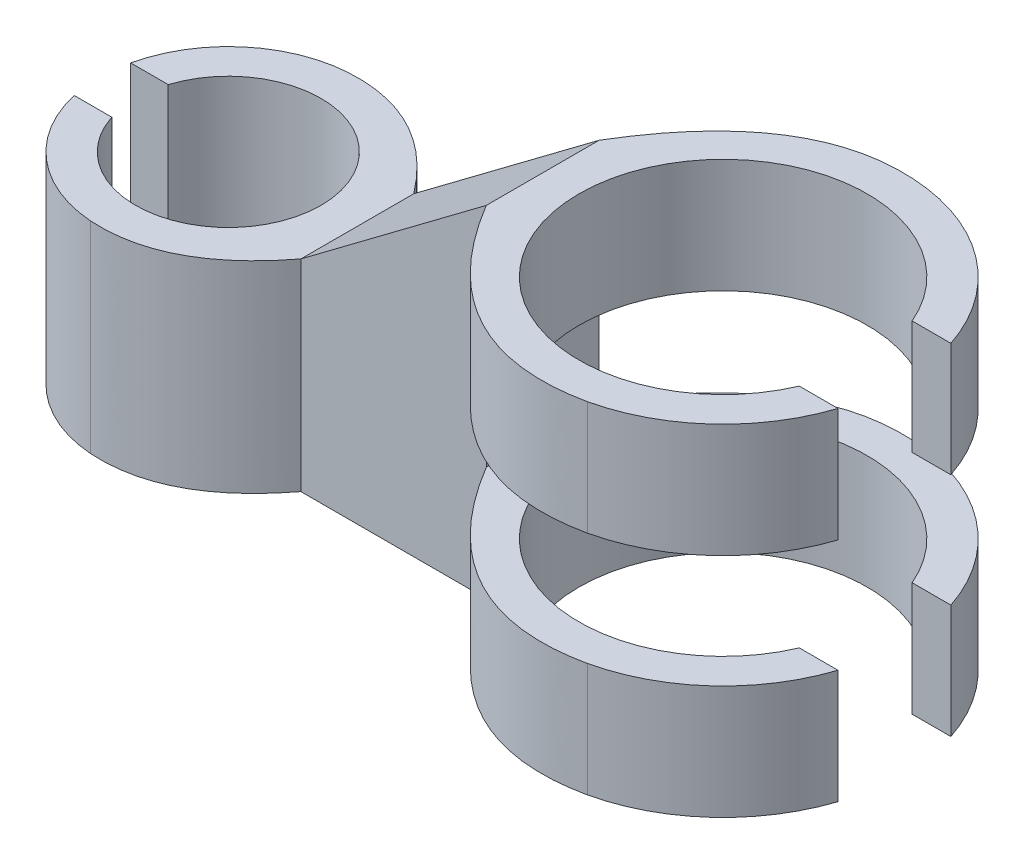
SolidWorks part; units mm, degrees
ref_plane "Front Plane" through (0, 0, 0) normal (0, 0, 1) x (1, 0, 0)
ref_plane "Top Plane" through (0, 0, 0) normal (0, 1, 0) x (1, 0, 0)
ref_plane "Right Plane" through (0, 0, 0) normal (1, 0, 0) x (0, 0, -1)
sketch "Sketch1" plane through (0, 0, 0) normal (0, 1, 0) x (1, 0, 0)
  line L0 (2.3039, 2.9179) -> (2.3039, -13.1746) construction
  line L1 (-4.0961, -2.338) -> (37.7431, -2.338) construction
  line L2 (-4.0961, -2.338) -> (-19.3061, -2.338) construction
  line L3 (2.3039, 0.462) -> (11.5039, 0.462)
  line L4 (2.3039, 0.462) -> (2.3039, -5.138)
  line L5 (2.3039, -5.138) -> (11.5039, -5.138)
  line L6 (11.5039, 0.462) -> (11.5039, -5.138)
  circle A0 centre (-4.0961, -2.338) radius 4.6
  circle A1 centre (-4.0961, -2.338) radius 6.4
  circle A2 centre (20.4539, -2.338) radius 8.95
  circle A3 centre (20.4539, -2.338) radius 7.15
  spline S0 degree 2 poles (2.3039, 0.462) (-0.6194, 4.2972) (-4.5379, 4.0468) knots 0 0 0 1 1 1
  spline S1 degree 2 poles (2.3039, -5.138) (-0.6194, -8.9732) (-4.5379, -8.7227) knots 0 0 0 1 1 1
  spline S2 degree 2 poles (11.5039, 0.462) (15.8881, 7.7924) (22.4538, 6.3857) knots 0 0 0 1 1 1
  spline S3 degree 2 poles (11.5039, -5.138) (15.8881, -12.4684) (22.4538, -11.0617) knots 0 0 0 1 1 1
  point P5 (2.3039, -2.338)
  point P6 (22.8786, -2.338)
  point P7 (22.8786, -2.338)
  point P19 (0, 0)
  point P25 (0, 0)
  point P27 (11.5039, 0.462)
  point P28 (11.5039, -2.338)
  dimension "D1" = 9.2
  dimension "D2" = 12.8
  dimension "D7" = 17.9
  dimension "D5" = 14.3
  dimension "D3" = 5.6
  dimension "D4" = 9.2
extrude "Boss-Extrude1" add sketch "Sketch1" along normal blind 10 contours S1 A1 S0 A0 | S1 L4 A1 | L4 S0 A1 | L6 L3 L4 L5
sketch "Sketch2" plane through (0, 0, 0) normal (0, -1, 0) x (1, 0, 0)
  arc A0 (20.4539, 11.288) -> (20.4539, -6.612) centre (20.4539, 2.338) cw
  circle A1 centre (20.4539, 2.338) radius 7.15
  spline S0 degree 2 poles (11.5039, -0.462) (15.8881, -7.7924) (22.4538, -6.3857) knots 0 0 0 1 1 1
  spline S1 degree 2 poles (11.5039, 5.138) (15.8881, 12.4684) (22.4538, 11.0617) knots 0 0 0 1 1 1
  dimension "D1" = 14.3
extrude "Boss-Extrude2" add sketch "Sketch2" against normal blind 16.9 contours S1 S0 A0 A1 M5
sketch "Sketch3" plane through (0, 0, -0.462) normal (0, 0, -1) x (-1, 0, 0)
  line L0 (-11.5039, 10) -> (-11.5039, 16.9)
  line L1 (-11.5039, 10) -> (-11.5039, 0) construction
  line L2 (-2.3039, 10) -> (-11.5039, 10) construction
  line L3 (-11.5039, 10) -> (-2.3039, 10)
  line L4 (-2.3039, 10) -> (-11.5039, 16.9)
extrude "Boss-Extrude3" add sketch "Sketch3" against normal blind 5.6
sketch "Sketch4" plane through (0, 16.9, 0) normal (0, 1, 0) x (1, 0, 0)
  line L0 (11.5039, 0.462) -> (11.5039, -5.138)
  arc A0 (20.4539, 6.612) -> (20.4539, -11.288) centre (20.4539, -2.338) cw
  circle A1 centre (20.4539, -2.338) radius 7.15
  spline S0 degree 2 poles (11.5039, 0.462) (15.8881, 7.7924) (22.4538, 6.3857) knots 0 0 0 1 1 1
  spline S1 degree 2 poles (11.5039, -5.138) (15.8881, -12.4684) (22.4538, -11.0617) knots 0 0 0 1 1 1
extrude "Cut-Extrude1" cut sketch "Sketch4" against normal blind 5.6 from offset 5.65 contours M4 M1 M2 M3 M5
sketch "Sketch5" plane through (0, 16.9, 0) normal (0, 1, 0) x (1, 0, 0)
  line L0 (27.6039, -2.338) -> (27.6039, 14.5789) construction
  line L1 (-4.0961, -2.338) -> (37.7431, -2.338) construction
  line L2 (27.6039, -2.338) -> (27.6039, -12.3646) construction
  line L3 (29.4039, -2.338) -> (29.4039, 14.5789) construction
  line L4 (29.4039, 14.5789) -> (29.4039, -2.338) construction
  line L5 (29.4039, -2.338) -> (29.4039, -12.3646) construction
  line L6 (2.3039, 0.462) -> (11.5039, 0.462) construction
  line L7 (2.3039, -0.938) -> (-36.2449, -0.938) construction
  line L8 (2.3039, 0.462) -> (2.3039, -5.138) construction
  line L9 (2.3039, -3.738) -> (-31.9092, -3.738) construction
  line L11 (-4.0961, -2.338) -> (-19.3061, -2.338) construction
  line L13 (-12.0851, -0.938) -> (-7.1268, -0.938)
  line L14 (-12.0851, -0.938) -> (-12.0851, -3.738)
  line L15 (-12.0851, -3.738) -> (-7.1268, -3.738)
  line L16 (-7.1268, -0.938) -> (-7.1268, -3.738)
  circle A0 centre (20.4539, -2.338) radius 7.15 construction
  circle A1 centre (20.4539, -2.338) radius 8.95 construction
  dimension "D1" = 2.8
  dimension "D3" = 1.4
  dimension "D4" = 1.4
extrude "Cut-Extrude3" cut sketch "Sketch5" against normal blind 18.6
sketch "Sketch6" plane through (0, 16.9, 0) normal (0, 1, 0) x (1, 0, 0)
  line L0 (11.5039, 0.462) -> (34.8614, 0.462) construction
  line L1 (11.5039, -5.138) -> (35.7905, -5.138) construction
  line L3 (25.013, 0.462) -> (32.136, 0.462)
  line L4 (25.013, 0.462) -> (25.013, -5.138)
  line L5 (25.013, -5.138) -> (32.136, -5.138)
  line L6 (32.136, 0.462) -> (32.136, -5.138)
extrude "Cut-Extrude4" cut sketch "Sketch6" against normal blind 18.6
